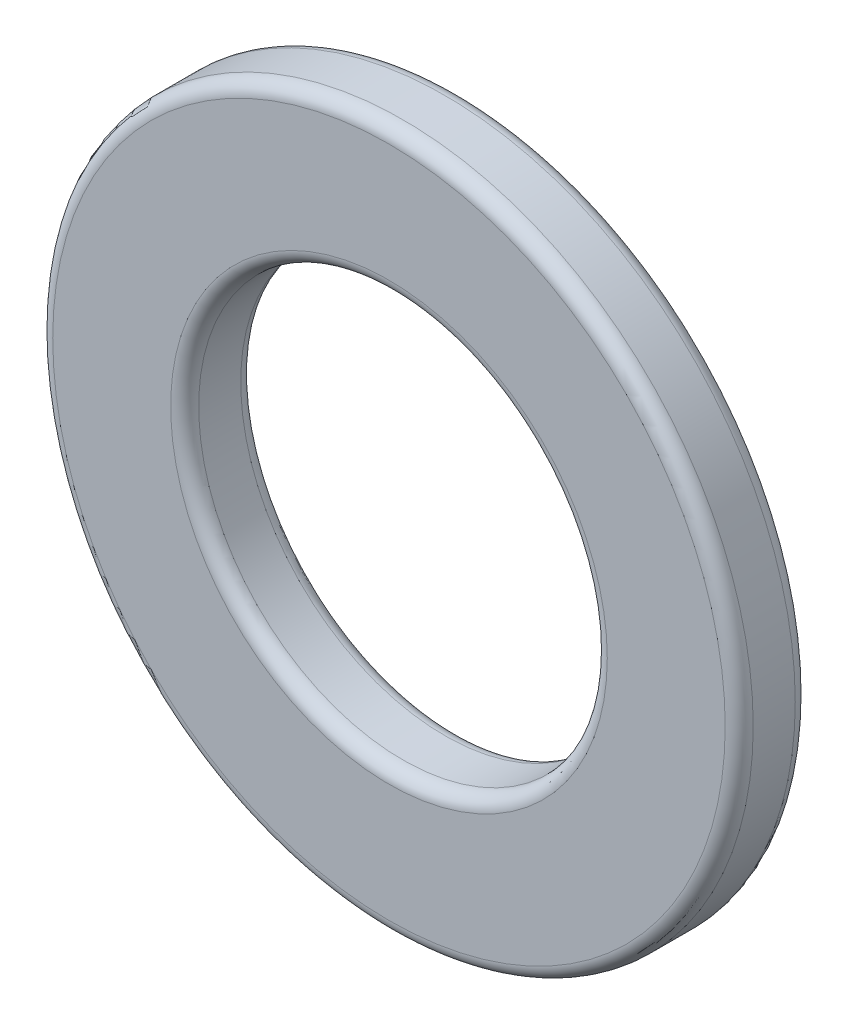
SolidWorks part; units mm, degrees
ref_plane "Front Plane" through (0, 0, 0) normal (0, 0, 1) x (1, 0, 0)
ref_plane "Top Plane" through (0, 0, 0) normal (0, 1, 0) x (1, 0, 0)
ref_plane "Right Plane" through (0, 0, 0) normal (1, 0, 0) x (0, 0, -1)
sketch "Sketch1" plane through (0, 0, 0) normal (0, 0, 1) x (1, 0, 0)
  circle A0 centre (0, 0) radius 9 construction
  circle A1 centre (0, 0) radius 5.25 construction
  point P5 (0, -9)
sketch "Sketch2" plane through (0, 0, 0) normal (1, 0, 0) x (0, 0, -1)
  line L0 (0.7, 0) -> (-0.7, 0) construction
  line L1 (-0.9, -9) -> (0.9, -9) construction
  point P0 (-0.9, -9)
  point P3 (0.9, -9)
  point P4 (0, 0)
  point P9 (0, -9)
  point P10 (0.7, -9)
  point P11 (-0.9, -9)
  point P12 (-0.7, -9)
  point P13 (0.9, -9)
  dimension "Thickness Range [Min]" = 1.4
  dimension "Thickness Range [Max]" = 1.8
sketch "Sketch3" plane through (0, 0, 0) normal (0, 0, 1) x (1, 0, 0)
  circle A0 centre (0, 0) radius 5.25 construction
  circle A1 centre (0, 0) radius 9 construction
  circle A2 centre (0, 0) radius 5.25
  circle A3 centre (0, 0) radius 9
extrude "Boss-Extrude1" add sketch "Sketch3" against normal up to vertex (0.9 mm away) and the other way up to vertex (0.9 mm away)
fillet "Fillet1" radius 0.36 4 edges at (9, 0, -0.9) (5.25, 0, -0.9) (5.25, 0, 0.9) (9, 0, 0.9)
equation "\"D1@Fillet1\"=\"OD@Sketch1\"*.02"
